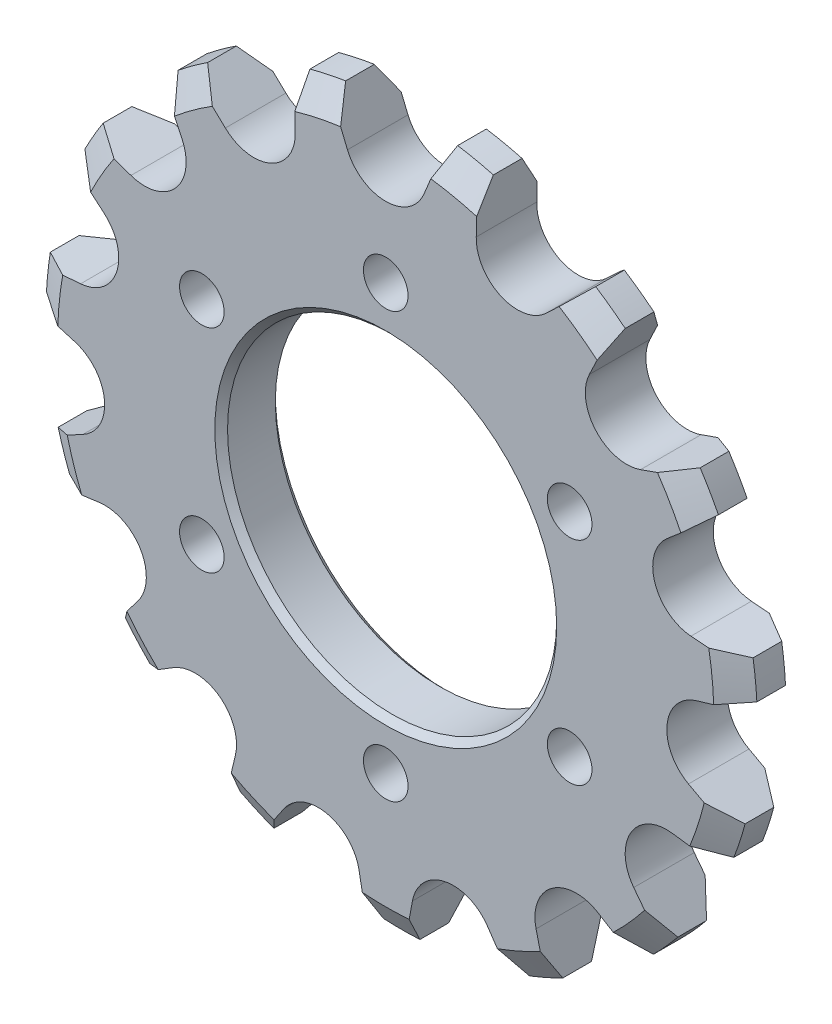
SolidWorks part; units mm, degrees
ref_plane "正面" through (0, 0, 0) normal (0, 0, 1) x (1, 0, 0)
ref_plane "平面" through (0, 0, 0) normal (0, 1, 0) x (1, 0, 0)
ref_plane "右側面" through (0, 0, 0) normal (1, 0, 0) x (0, 0, -1)
sketch "ｽｹｯﾁ1" plane through (0, 0, 0) normal (0, 0, 1) x (1, 0, 0)
  circle A0 centre (0, 0) radius 33.5
  dimension "D1" = 67
extrude "ﾎﾞｽ - 押し出し1" add sketch "ｽｹｯﾁ1" along normal blind 5.7
chamfer "面取り1" distance 1.5 angle 60 2 edges at (33.5, 0, 0) (33.5, 0, 5.7)
sketch "ｽｹｯﾁ2" plane through (0, 0, 5.7) normal (0, 0, 1) x (1, 0, 0)
  line L0 (0, 0) -> (0, 30.54) construction
  line L1 (-3.6031, 29.0475) -> (-5.2743, 33.0822)
  line L2 (3.6031, 29.0475) -> (5.2743, 33.0822)
  arc A0 (-3.6031, 29.0475) -> (3.6031, 29.0475) centre (0, 30.54) ccw
  arc A1 (5.2743, 33.0822) -> (-5.2743, 33.0822) centre (0, 0) ccw
  circle A2 centre (0, 0) radius 33.5 construction
  point P8 (-8.9918, 36.3862)
  point P10 (7.8295, 35.4334)
  dimension "D1" = 7.8
  dimension "D2" = 30.54
  dimension "D3" = 45
extrude "ｶｯﾄ - 押し出し1" cut sketch "ｽｹｯﾁ2" against normal through all
pattern_circular "円形ﾊﾟﾀｰﾝ1" count 15 over 360 about axis through (0, 0, 0) along (0, 0, 1) of "ｶｯﾄ - 押し出し1"
sketch "ｽｹｯﾁ3" plane through (0, 0, 5.7) normal (0, 0, 1) x (1, 0, 0)
  circle A0 centre (0, 0) radius 15.5
  dimension "D1" = 31
extrude "ｶｯﾄ - 押し出し2" cut sketch "ｽｹｯﾁ3" against normal through all
hole_wizard "M5x0.8 ねじ穴1" positions "ｽｹｯﾁ4" profile "ｽｹｯﾁ5" tap size "M5x0.8" standard "JIS"
sketch "ｽｹｯﾁ4" plane through (0, 0, 5.7) normal (0, 0, 1) x (1, 0, 0)
  line L0 (0, 0) -> (0, 20) construction
  circle A0 centre (0, 20) radius 4.5 construction
  point P0 (0, 20)
  dimension "D1" = 9
  dimension "D2" = 20
sketch "ｽｹｯﾁ5" plane through (0, 20, 5.7) normal (1, 0, 0) x (0, -1, 0)
  line L0 (0, 0) -> (0, 5.7)
  line L1 (0, 5.7) -> (2.1, 5.7)
  line L2 (2.1, 5.7) -> (2.1, 0)
  line L5 (2.1, 0) -> (0, 0)
  line L11 (0, -6.35) -> (0, 107.95) construction
  dimension "ねじ山の主要直径" = 4.2
  dimension "次ｻｰﾌｪｽまでのねじ下穴ﾄﾞﾘﾙの深さ" = 5.7
pattern_circular "円形ﾊﾟﾀｰﾝ2" count 6 over 360 about axis through (0, 0, 0) along (0, 0, 1) of "M5x0.8 ねじ穴1"
chamfer "面取り2" distance 0.6 angle 45 2 edges at (15.5, 0, 5.7) (15.5, 0, 0)
